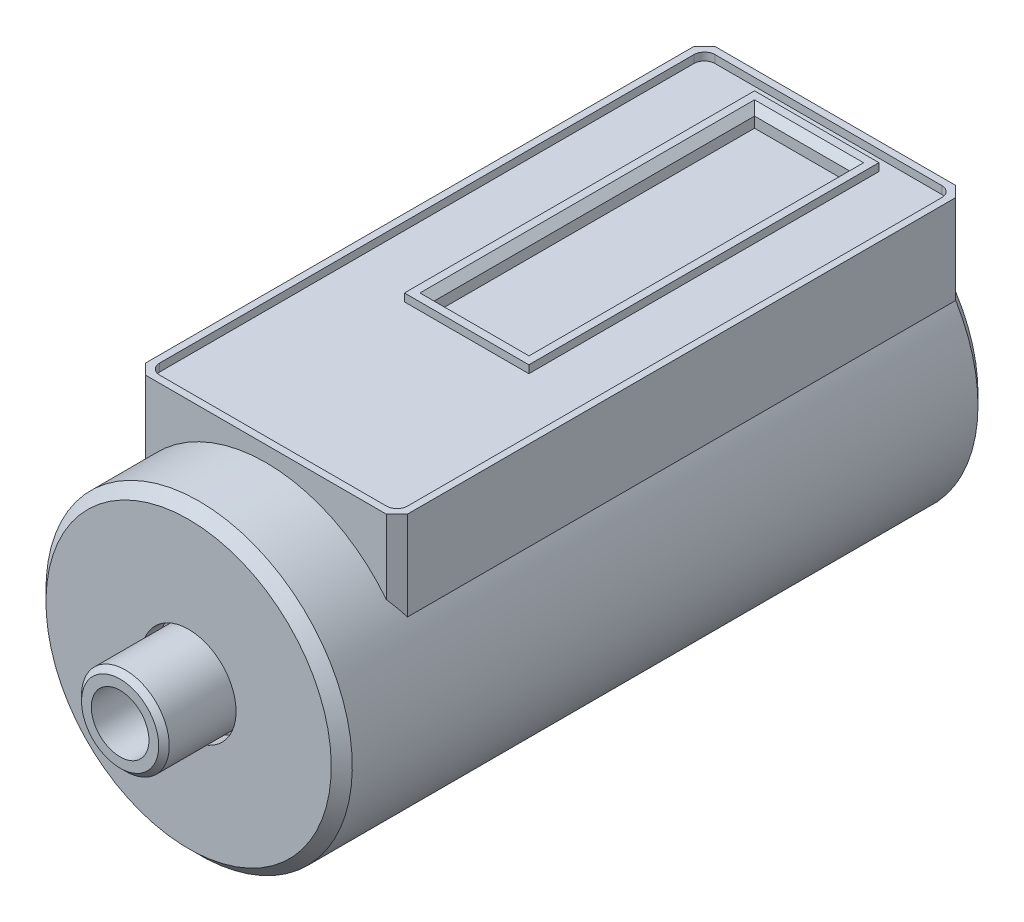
SolidWorks part; units mm, degrees
ref_plane "Front" through (0, 0, 0) normal (0, 0, 1) x (1, 0, 0)
ref_plane "Top" through (0, 0, 0) normal (0, 1, 0) x (1, 0, 0)
ref_plane "Right" through (0, 0, 0) normal (1, 0, 0) x (0, 0, -1)
sketch "Sketch2" plane through (0, 0, 0) normal (1, 0, 0) x (0, 0, -1)
  line L0 (24.31, 0) -> (24.31, 2.79)
  line L1 (24.69, 3.17) -> (30.53, 3.17)
  line L2 (29.26, 3.43) -> (29.26, 10.31)
  line L3 (30.02, 11.07) -> (76, 11.07)
  line L4 (76, 11.07) -> (76, 0)
  line L5 (76, 0) -> (24.31, 0)
  line L6 (29.26, 3.43) -> (30.53, 3.43)
  line L7 (30.53, 3.43) -> (30.53, 3.17)
  line L8 (24.31, 2.79) -> (24.69, 3.17)
  line L9 (29.26, 10.31) -> (30.02, 11.07)
  dimension "D1" = 51.69
  dimension "D2" = 3.17
  dimension "D3" = 11.07
  dimension "D4" = 4.95
  dimension "D5" = 1.27
  dimension "D6" = 3.43
  dimension "D7" = 2.79
  dimension "D8" = 0.38
  dimension "D9" = 0.76
  dimension "D10" = 10.31
  dimension "D11" = 76
revolve "Revolve1" add sketch "Sketch2" angle 360 about L5
sketch "Sketch3" plane through (0, 0, 0) normal (0, 1, 0) x (1, 0, 0)
  line L0 (11.07, 76) -> (-11.07, 76) construction
  line L1 (-9.46, 76) -> (9.46, 76)
  line L2 (-9.46, 76) -> (-9.46, 35.61)
  line L3 (-8.7, 34.85) -> (8.7, 34.85)
  line L4 (9.46, 76) -> (9.46, 35.61)
  line L5 (-9.46, 35.61) -> (-8.7, 34.85)
  line L6 (9.46, 35.61) -> (8.7, 34.85)
  point P1 (9.46, 34.85)
  point P2 (-9.46, 34.85)
  point P6 (0, 34.85)
  dimension "D1" = 41.15
  dimension "D2" = 18.92
extrude "Extrude1" add sketch "Sketch3" along normal blind 12.19
chamfer "Chamfer1" distance 0.76 angle 45 3 edges at (-9.46, 8.9696, -76) (0, -11.07, -76) (9.46, 8.9696, -76)
sketch "Sketch4" plane through (0, 12.19, 0) normal (0, 1, 0) x (1, 0, 0)
  line L0 (-8.7, 34.85) -> (8.7, 34.85) construction
  line L1 (-8.19, 75.49) -> (8.2, 75.49)
  line L2 (-8.95, 74.73) -> (-8.95, 36.12)
  line L3 (-8.19, 35.36) -> (8.2, 35.36)
  line L4 (8.96, 74.73) -> (8.96, 36.12)
  line L5 (-9.46, 35.61) -> (-9.46, 75.24) construction
  line L7 (-4.49, 74.65) -> (4.5, 74.65)
  line L8 (-4.49, 74.65) -> (-4.49, 49.35)
  line L9 (-4.49, 49.35) -> (4.5, 49.35)
  line L10 (4.5, 74.65) -> (4.5, 49.35)
  arc A0 (-8.95, 74.73) -> (-8.19, 75.49) centre (-8.19, 74.73) cw
  arc A1 (8.96, 74.73) -> (8.2, 75.49) centre (8.2, 74.73) ccw
  arc A2 (8.96, 36.12) -> (8.2, 35.36) centre (8.2, 36.12) cw
  arc A3 (-8.95, 36.12) -> (-8.19, 35.36) centre (-8.19, 36.12) ccw
  dimension "D5" = 0.76
  dimension "D1" = 17.91
  dimension "D2" = 40.13
  dimension "D3" = 0.51
  dimension "D4" = 0.51
  dimension "D6" = 0.84
  dimension "D7" = 4.46
  dimension "D8" = 4.46
  dimension "D9" = 25.3
extrude "Cut-Extrude1" cut sketch "Sketch4" against normal blind 0.56
sketch "Sketch5" plane through (0, 12.19, 0) normal (0, 1, 0) x (1, 0, 0)
  line L1 (-3.42, 73.58) -> (3.44, 73.58)
  line L2 (-3.42, 73.58) -> (-3.42, 50.42)
  line L3 (-3.42, 50.42) -> (3.44, 50.42)
  line L4 (3.44, 73.58) -> (3.44, 50.42)
  line L6 (4.5, 74.65) -> (-4.49, 74.65) construction
  line L7 (-4.49, 74.65) -> (-4.49, 49.35) construction
  point P4 (0.005, 74.65)
  dimension "D1" = 6.86
  dimension "D2" = 23.16
  dimension "D3" = 1.07
  dimension "D4" = 1.07
extrude "Cut-Extrude2" cut sketch "Sketch5" against normal blind 1.27
chamfer "Chamfer2" distance 0.51 angle 45 4 edges at (0.01, 12.19, -50.42) (3.44, 12.19, -62) (-3.42, 12.19, -62) (0.01, 12.19, -73.58)
hole_wizard "Hole1" positions "Sketch7" profile "Sketch6" legacy
sketch "Sketch7" plane through (0, 0, -24.31) normal (0, 0, 1) x (1, 0, 0)
  circle A0 centre (0, 0) radius 3.17 construction
  point P0 (0, 0)
sketch "Sketch6" plane through (0, 0, -24.31) normal (1, 0, 0) x (0, -1, 0)
  line L0 (0, 0) -> (0, 7.6015)
  line L1 (0, 7.6015) -> (2.0828, 6.35)
  line L2 (2.0828, 6.35) -> (2.0828, 0)
  line L4 (2.0828, 0) -> (0, 0)
  line L6 (0, 7.6015) -> (-2.0828, 6.35) construction
  line L7 (0, -4.2442) -> (0, 117.3081) construction
  dimension "Diameter" = 4.1656
  dimension "Depth" = 6.35
  dimension "Drill Angle" = 118
